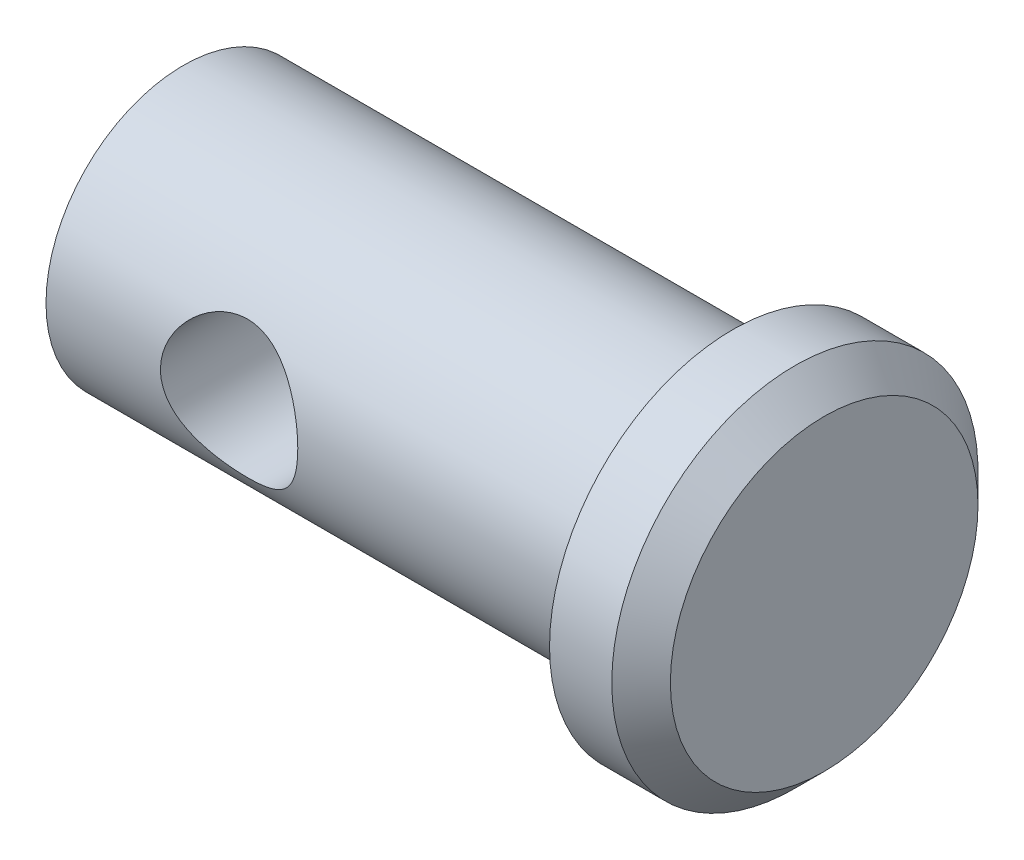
SolidWorks part; units mm, degrees
ref_plane "Front Plane" through (0, 0, 0) normal (0, 0, 1) x (1, 0, 0)
ref_plane "Top Plane" through (0, 0, 0) normal (0, 1, 0) x (1, 0, 0)
ref_plane "Right Plane" through (0, 0, 0) normal (1, 0, 0) x (0, 0, -1)
sketch "Sketch1" plane through (0, 0, 0) normal (0, 0, 1) x (1, 0, 0)
  line L0 (0, 0) -> (11.1125, 0) construction
  line L1 (0, 0) -> (0, 2.3813)
  line L2 (0, 2.3813) -> (9.525, 2.3813)
  line L3 (9.525, 2.3813) -> (9.525, 3.175)
  line L4 (9.525, 3.175) -> (11.1125, 3.175)
  line L5 (11.1125, 3.175) -> (11.1125, 0)
  line L6 (12.629, 0) -> (23.1864, 0) construction
  line L8 (11.1125, 0) -> (0, 0)
  dimension "D1" = 4.7625
  dimension "D2" = 6.35
  dimension "D3" = 1.5875
  dimension "D4" = 9.525
revolve "Revolve1" add sketch "Sketch1" angle 360 about L0
chamfer "Chamfer1" distance 0.508 angle 45 1 edges at (11.1125, 0, 3.175)
sketch "Sketch2" plane through (0, 0, 0) normal (0, 0, 1) x (1, 0, 0)
  line L0 (0, 2.3813) -> (0, -2.3813) construction
  circle A0 centre (3.175, 0) radius 1.1906
  dimension "D1" = 2.3813
  dimension "D2" = 3.175
extrude "Cut-Extrude1" cut sketch "Sketch2" against normal through all and the other way through all
